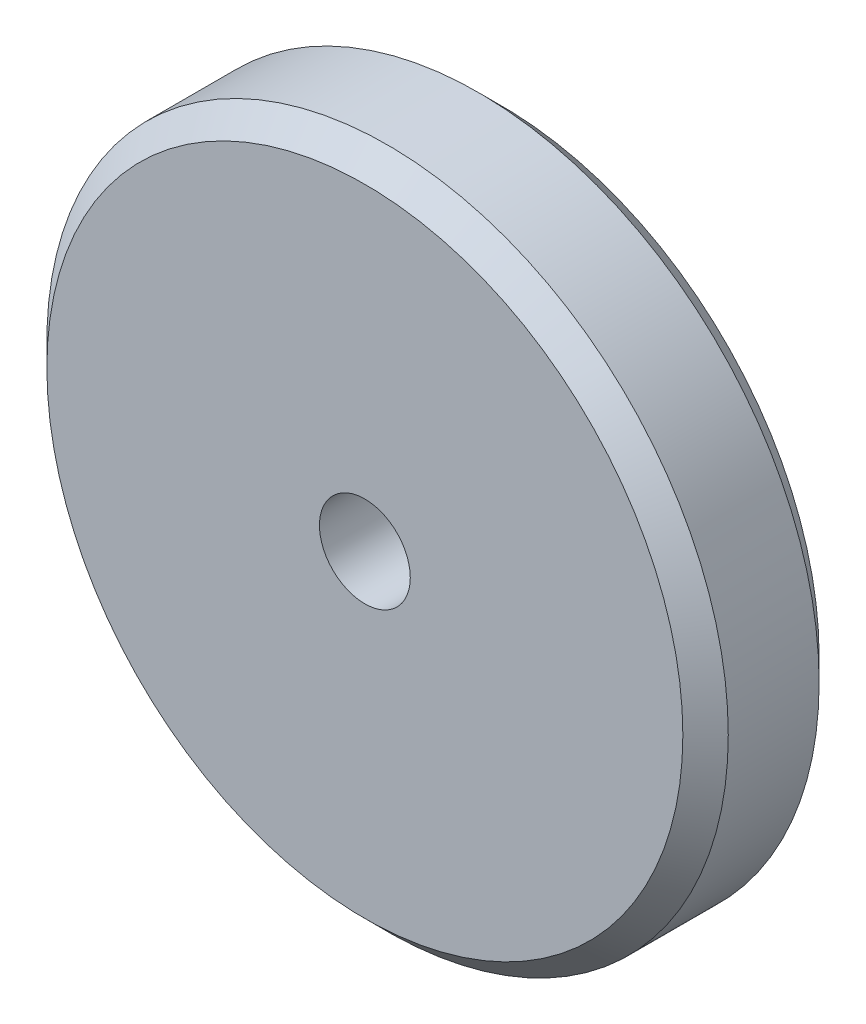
SolidWorks part; units mm, degrees
ref_plane "Front" through (0, 0, 0) normal (0, 0, 1) x (1, 0, 0)
ref_plane "Top" through (0, 0, 0) normal (0, 1, 0) x (1, 0, 0)
ref_plane "Right" through (0, 0, 0) normal (1, 0, 0) x (0, 0, -1)
sketch "Sketch1" plane through (0, 0, 0) normal (0, 0, 1) x (1, 0, 0)
  circle A0 centre (0, 0) radius 2
  circle A1 centre (0, 0) radius 15
extrude "Extrude1" add sketch "Sketch1" along normal blind 6
chamfer "Chamfer1" distance 1 angle 45 2 edges at (15, 0, 0) (15, 0, 6)
